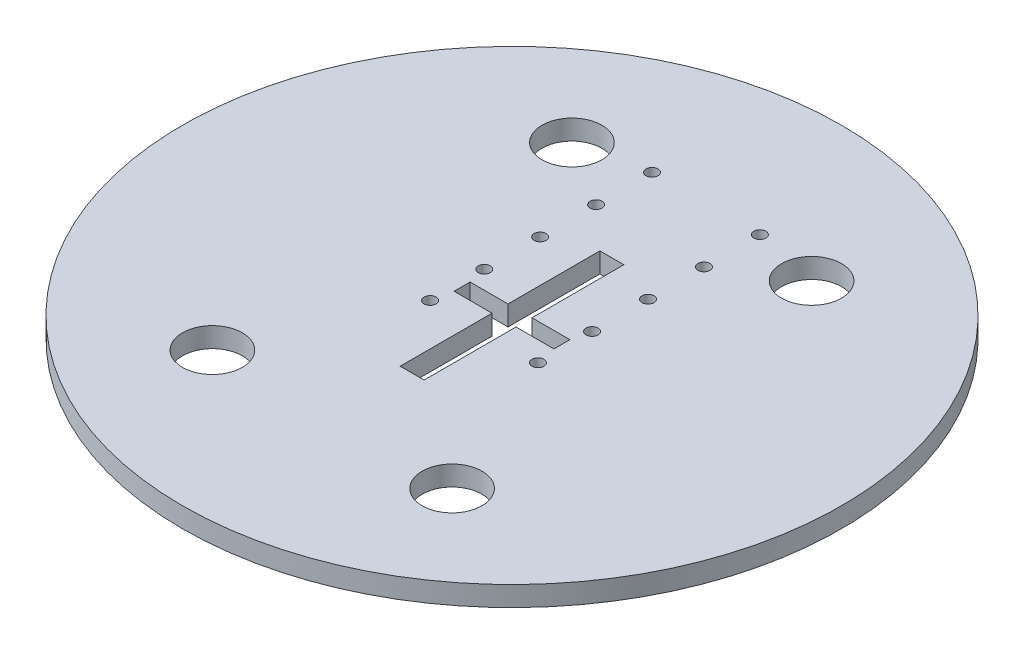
SolidWorks part; units mm, degrees
ref_plane "Front Plane" through (0, 0, 0) normal (0, 0, 1) x (1, 0, 0)
ref_plane "Top Plane" through (0, 0, 0) normal (0, 1, 0) x (1, 0, 0)
ref_plane "Right Plane" through (0, 0, 0) normal (1, 0, 0) x (0, 0, -1)
sketch "Sketch1" plane through (0, 0, 0) normal (0, 1, 0) x (1, 0, 0)
  circle A0 centre (0, 0) radius 82.5
  dimension "D1" = 165
extrude "Boss-Extrude1" add sketch "Sketch1" along normal blind 5
sketch "Sketch3" plane through (0, 5, 0) normal (0, 1, 0) x (1, 0, 0)
  line L8 (-51.3214, 0) -> (62.63, 0) construction
  line L13 (0, 61.8027) -> (0, -40) construction
  line L14 (-13.5, -40) -> (-13.5, 53.1) construction
  line L15 (13.5, -40) -> (13.5, 61.8027) construction
  line L16 (0, 0) -> (-13.5, 0) construction
  line L17 (-13.5, 0) -> (-13.5, 6.55) construction
  circle A12 centre (-13.5, 6.55) radius 1.5
  circle A13 centre (-13.5, -7) radius 1.5
  circle A14 centre (-13.5, 20.55) radius 1.5
  circle A15 centre (-13.5, 34.55) radius 1.5
  circle A16 centre (-13.5, 48.55) radius 1.5
  circle A17 centre (13.5, -7) radius 1.5
  circle A18 centre (13.5, 6.55) radius 1.5
  circle A19 centre (13.5, 20.55) radius 1.5
  circle A20 centre (13.5, 34.55) radius 1.5
  circle A21 centre (13.5, 48.55) radius 1.5
  point P31 (0, 0)
  point P32 (0, 0)
  dimension "D3" = 14
  dimension "D4" = 14
  dimension "D1" = 13.55
  dimension "D2" = 14
sketch "Sketch5" plane through (0, 5, 0) normal (0, 1, 0) x (1, 0, 0)
  circle A0 centre (30, -45) radius 7.5
  circle A1 centre (-30, -45) radius 7.5
  circle A2 centre (30, 45) radius 7.5
  circle A3 centre (-30, 45) radius 7.5
  dimension "D1" = 15
extrude "Cut-Extrude3" cut sketch "Sketch5" against normal through all
sketch "Sketch6" plane through (0, 5, 0) normal (0, 1, 0) x (1, 0, 0)
  line L5 (3, 25) -> (-3, 25)
  line L6 (3, 25) -> (3, -25)
  line L7 (3, -25) -> (-3, -25)
  line L8 (-3, 25) -> (-3, -25)
  point P0 (0, 0)
  point P1 (0, 0)
  dimension "D1" = 6
  dimension "D2" = 50
extrude "Cut-Extrude4" cut sketch "Sketch6" against normal through all
sketch "Sketch7" plane through (0, 5, 0) normal (0, 1, 0) x (1, 0, 0)
  line L5 (-12.5, 2) -> (12.5, 2)
  line L6 (-12.5, 2) -> (-12.5, -2)
  line L7 (-12.5, -2) -> (12.5, -2)
  line L8 (12.5, 2) -> (12.5, -2)
  point P0 (0, 0)
  point P1 (0, 0)
  dimension "D1" = 25
  dimension "D2" = 4
extrude "Cut-Extrude5" cut sketch "Sketch7" against normal through all
extrude "Cut-Extrude10" cut sketch "Sketch3" against normal through all
